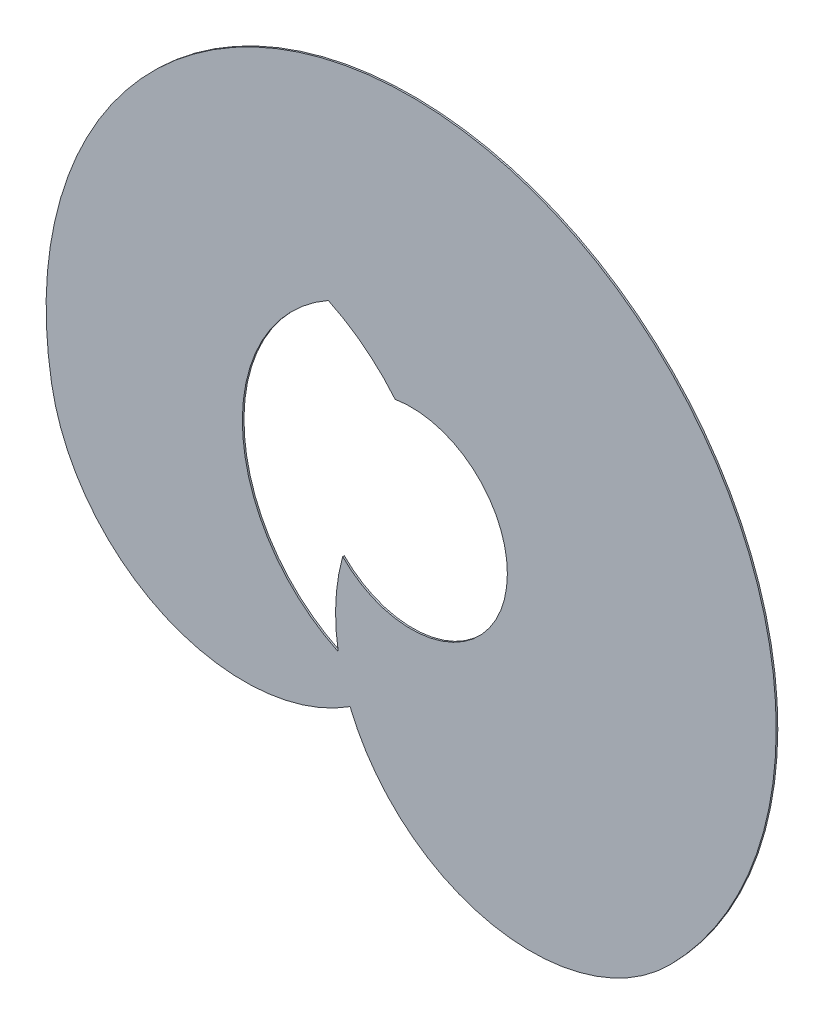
SolidWorks part; units mm, degrees
ref_plane "前视基准面" through (0, 0, 0) normal (0, 0, 1) x (1, 0, 0)
ref_plane "上视基准面" through (0, 0, 0) normal (0, 1, 0) x (1, 0, 0)
ref_plane "右视基准面" through (0, 0, 0) normal (1, 0, 0) x (0, 0, -1)
sketch "草图1" plane through (0, 0, 0) normal (0, 0, 1) x (1, 0, 0)
  line L0 (0, 860.3204) -> (0, -27.1227) construction
  line L1 (-196.265, 0) -> (315.568, 0) construction
  line L2 (25, 400) -> (-288.1689, 344.7799) construction
  line L3 (25, 400) -> (249.86, 175.14) construction
  line L4 (25, 826.2586) -> (25, 293.1611) construction
  line L5 (249.86, 175.14) -> (276.858, 197.4134) construction
  line L6 (276.858, 197.4134) -> (509.1378, -84.1378) construction
  line L7 (-288.1689, 344.7799) -> (-285.409, 309.8889) construction
  line L8 (-285.409, 309.8889) -> (-649.2725, 281.1076) construction
  line L9 (249.86, 175.14) -> (237.3171, 142.4647) construction
  line L10 (237.3171, 142.4647) -> (-103.4398, 273.269) construction
  line L11 (1319.5558, 926.8817) -> (1319.5558, 45.241) construction
  line L12 (1319.5558, 45.241) -> (1296.2796, -86.7648) construction
  line L13 (1319.5558, 45.241) -> (1343.4101, -90.0433) construction
  line L14 (1319.5558, 190.9816) -> (1233.0536, 175.7289) construction
  line L15 (1319.5558, 190.9816) -> (1398.5703, 111.9671) construction
  line L16 (1319.5558, 372.2851) -> (1240.1314, 326.4294) construction
  line L17 (1319.5558, 372.2851) -> (1365.0367, 270.1334) construction
  line L18 (1319.5558, 631.6387) -> (1370.1273, 492.6947) construction
  line L19 (1319.5558, 631.6387) -> (1271.182, 498.7326) construction
  line L20 (1319.5558, 817.0834) -> (1182.6552, 680.1828) construction
  line L21 (1319.5558, 817.0834) -> (1471.4957, 665.1436) construction
  line L22 (-288.1689, 344.7799) -> (-261.3573, 367.2774) construction
  line L23 (-261.3573, 367.2774) -> (-26.7398, 87.6712) construction
  line L24 (-288.1689, 344.7799) -> (-307.7406, 373.7962) construction
  line L25 (-307.7406, 373.7962) -> (-5.1419, 577.9016) construction
  line L26 (249.86, 175.14) -> (216.0526, 184.1987) construction
  line L27 (216.0526, 184.1987) -> (310.5215, 536.7616) construction
  arc A0 (-103.4398, 273.269) -> (-111.7616, 114.4785) centre (249.86, 175.14) ccw
  arc A1 (509.1378, -84.1378) -> (-649.2725, 281.1076) centre (25, 400) ccw
  arc A2 (-649.2725, 281.1076) -> (-89.6036, 36.5237) centre (-288.1689, 344.7799) ccw
  arc A3 (-103.4398, 273.269) -> (-5.1419, 577.9016) centre (25, 400) ccw
  arc A4 (-89.6036, 36.5237) -> (509.1378, -84.1378) centre (249.86, 175.14) ccw
  arc A6 (-130.4423, 675.797) -> (-111.7616, 114.4785) centre (25, 400) ccw
  arc A7 (-5.1419, 577.9016) -> (-130.4423, 675.797) centre (-288.1689, 344.7799) ccw
  point P5 (25, 400)
  point P6 (25, 718)
  point P7 (390, 753)
  point P8 (479, 753)
  point P14 (90, 753)
  dimension "D1" = 35
  dimension "L12x" = 25
  dimension "D2" = 365
  dimension "L23z" = 318
  dimension "D3" = 170
  dimension "L12z" = 400
  dimension "D4" = 170
  dimension "L34mx" = 35
  dimension "D5" = 100
  dimension "L56z" = 89
  dimension "D6" = 135
  dimension "L35z" = 365
  dimension "D7" = 135
  dimension "D8" = 100
  dimension "D9" = 318
  dimension "L34z" = 65
  dimension "L45z" = 300
  dimension "D10" = 120
  dimension "D11" = 156
  dimension "D12" = 200
  dimension "D13" = 200
  dimension "D14" = 135
  dimension "D15" = 135
  dimension "D16" = 246
  dimension "D17" = 30
  dimension "D18" = 246
  dimension "D19" = 30
extrude "凸台-拉伸1" add sketch "草图1" along normal mid plane 3 from offset 200
equation "\"D9@草图1\" = \"L23z@草图1\""
equation "\"D1@草图1\" = \"L34mx@草图1\""
equation "\"D2@草图1\" = \"L35z@草图1\""
equation "\"D7@草图1\" = \"D6@草图1\""
equation "\"D8@草图1\" = \"D5@草图1\""
equation "\"D16@草图1\" = \"D11@草图1\"+90"
equation "\"D17@草图1\" = \"D10@草图1\"-90"
equation "\"D18@草图1\" = \"D11@草图1\"+90"
equation "\"D19@草图1\" = \"D10@草图1\"-90"
